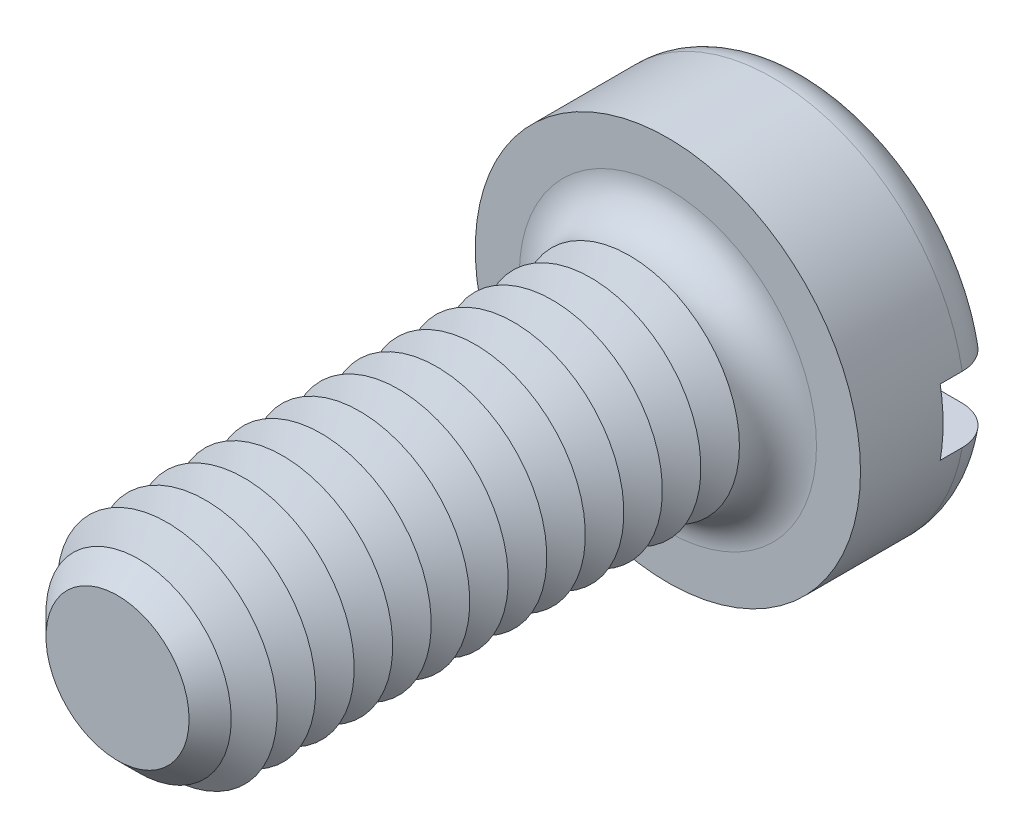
SolidWorks part; units mm, degrees
ref_plane "Front Plane" through (0, 0, 0) normal (0, 0, 1) x (1, 0, 0)
ref_plane "Top Plane" through (0, 0, 0) normal (0, 1, 0) x (1, 0, 0)
ref_plane "Right Plane" through (0, 0, 0) normal (1, 0, 0) x (0, 0, -1)
sketch "Sketch3" plane through (0, 0, 0) normal (0, 0, 1) x (1, 0, 0)
  circle A0 centre (0, 0) radius 3.5
  dimension "D1" = 7
extrude "Boss-Extrude2" add sketch "Sketch3" against normal blind 2.6
sketch "Sketch4" plane through (0, 0, 0) normal (0, 0, 1) x (1, 0, 0)
  circle A0 centre (0, 0) radius 2
  dimension "D1" = 4
extrude "Boss-Extrude3" add sketch "Sketch4" along normal blind 10
fillet "Fillet1" radius 0.7 2 edges at (3.5, 0, -2.6) (2, 0, 0)
chamfer "Chamfer1" distance 0.7 angle 45 1 edges at (2, 0, 10)
sketch "Sketch5" plane through (0, 0, 0) normal (1, 0, 0) x (0, 0, -1)
  line L0 (1.6944, 0) -> (-7.6738, 0) construction
sketch "Sketch6" plane through (0, 0, 0) normal (1, 0, 0) x (0, 0, -1)
  line L0 (-0.7, 2) -> (-1.05, 1.3938)
  line L1 (-1.05, 1.3938) -> (-1.4, 2)
  line L2 (-0.7, 2) -> (-9.3, 2) construction
  line L3 (-1.4, 2) -> (-0.7, 2)
  dimension "D1" = 0.7
revolve "Cut-Revolve1" cut sketch "Sketch6" angle 360 about L0
pattern_linear "LPattern1" count 13 spacing 0.7 along (0, 0, 1) of "Cut-Revolve1"
sketch "Sketch8" plane through (0, 0, -2.6) normal (0, 0, -1) x (-1, 0, 0)
  line L1 (3.5, -0.6) -> (-3.5, -0.6)
  line L2 (3.5, -0.6) -> (3.5, 0.6)
  line L3 (3.5, 0.6) -> (-3.5, 0.6)
  line L4 (-3.5, -0.6) -> (-3.5, 0.6)
  line L5 (3.5, -0.6) -> (-3.5, 0.6) construction
  line L6 (3.5, 0.6) -> (-3.5, -0.6) construction
  point P0 (0, 0)
  dimension "D1" = 7
  dimension "D2" = 1.2
extrude "Cut-Extrude1" cut sketch "Sketch8" against normal blind 1.1
